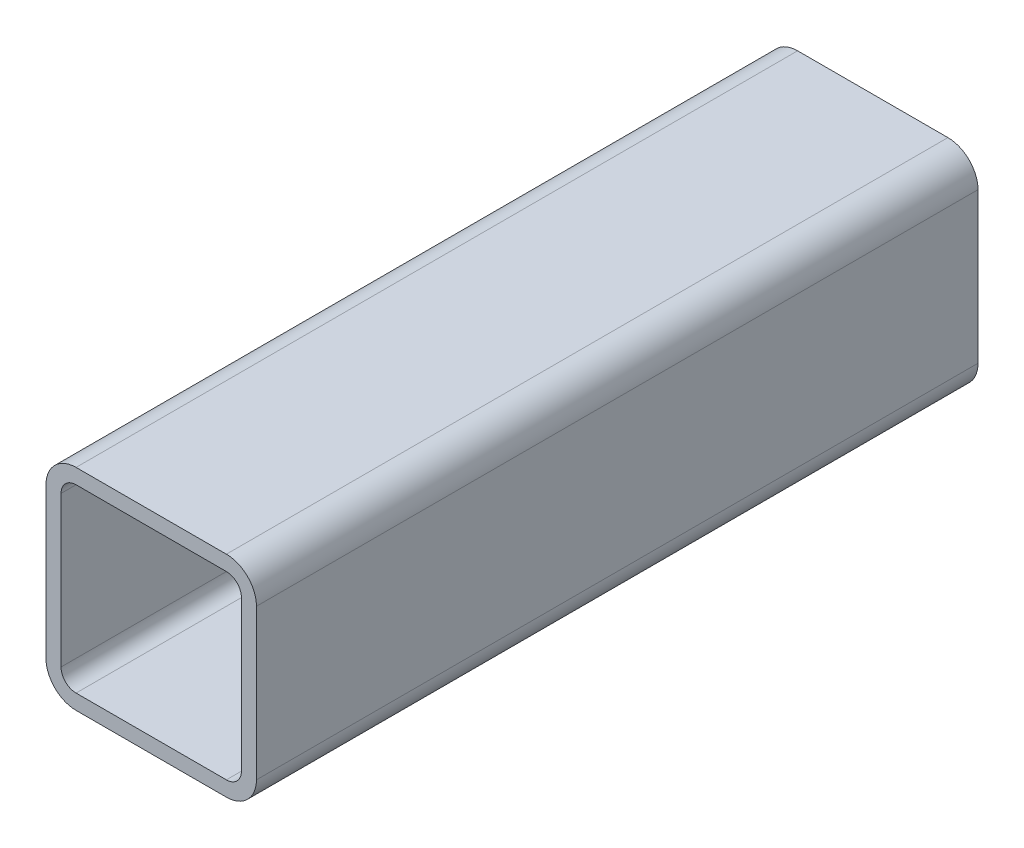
SolidWorks part; units mm, degrees
ref_plane "Front Plane" through (0, 0, 0) normal (0, 0, 1) x (1, 0, 0)
ref_plane "Top Plane" through (0, 0, 0) normal (0, 1, 0) x (1, 0, 0)
ref_plane "Right Plane" through (0, 0, 0) normal (1, 0, 0) x (0, 0, -1)
sketch "Sketch1" plane through (0, 0, 0) normal (0, 0, 1) x (1, 0, 0)
sketch_block_instance "HSS3.5x3.5x0.250-1"
sketch_block "HSS3.5x3.5x0.250"
extrude "Boss-Extrude1" add sketch "Sketch1" along normal blind 304.8
